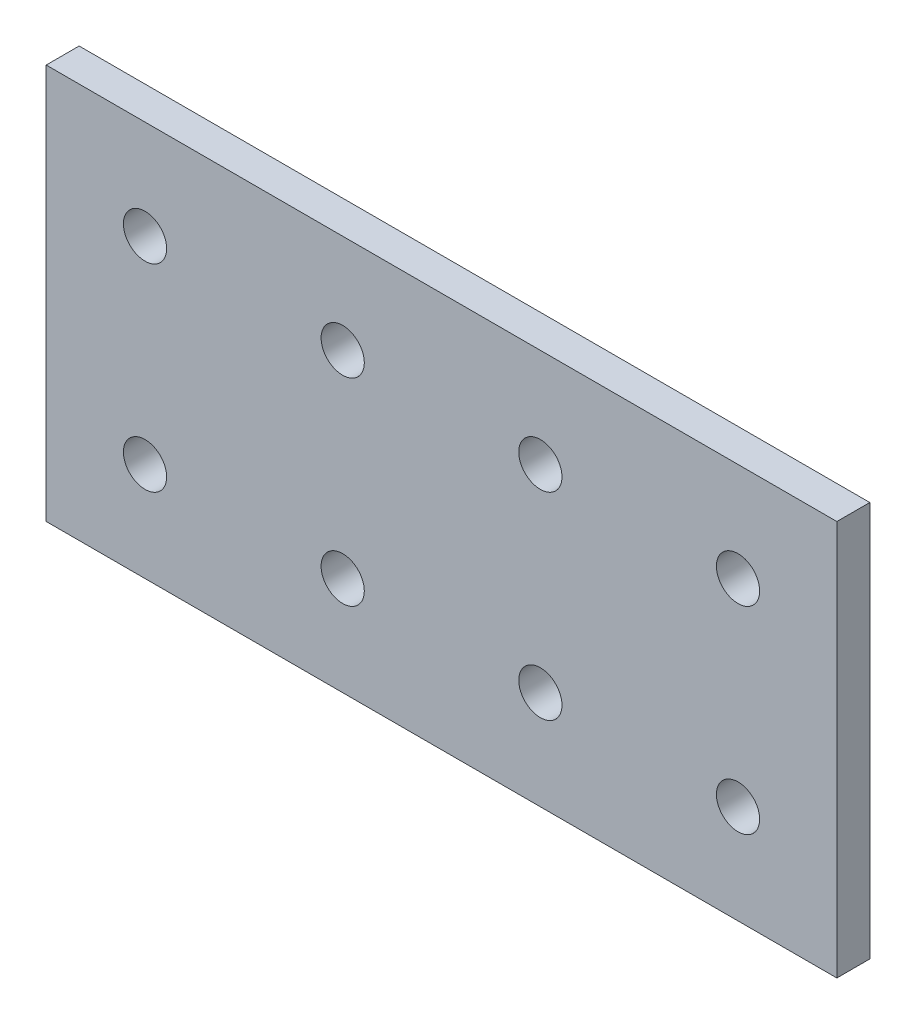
SolidWorks part; units mm, degrees
ref_plane "Front" through (0, 0, 0) normal (0, 0, 1) x (1, 0, 0)
ref_plane "Top" through (0, 0, 0) normal (0, 1, 0) x (1, 0, 0)
ref_plane "Right" through (0, 0, 0) normal (1, 0, 0) x (0, 0, -1)
sketch "Sketch1" plane through (0, 0, 0) normal (0, 0, 1) x (1, 0, 0)
  line L0 (0, 76.2) -> (152.4, 76.2)
  line L1 (0, 0) -> (152.4, 0)
  line L2 (0, 76.2) -> (0, 0)
  line L3 (152.4, 0) -> (152.4, 76.2)
  line L4 (11.7094, 19.05) -> (26.3906, 19.05) construction
  line L5 (19.05, 26.3906) -> (19.05, 11.7094) construction
  line L6 (11.7094, 57.15) -> (26.3906, 57.15) construction
  line L7 (19.05, 64.4906) -> (19.05, 49.8094) construction
  line L8 (49.8094, 19.05) -> (64.4906, 19.05) construction
  line L9 (57.15, 26.3906) -> (57.15, 11.7094) construction
  line L10 (49.8094, 57.15) -> (64.4906, 57.15) construction
  line L11 (57.15, 64.4906) -> (57.15, 49.8094) construction
  line L12 (87.9094, 19.05) -> (102.5906, 19.05) construction
  line L13 (95.25, 26.3906) -> (95.25, 11.7094) construction
  line L14 (87.9094, 57.15) -> (102.5906, 57.15) construction
  line L15 (95.25, 64.4906) -> (95.25, 49.8094) construction
  line L16 (126.0094, 19.05) -> (140.6906, 19.05) construction
  line L17 (133.35, 26.3906) -> (133.35, 11.7094) construction
  line L18 (126.0094, 57.15) -> (140.6906, 57.15) construction
  line L19 (133.35, 64.4906) -> (133.35, 49.8094) construction
  circle A0 centre (19.05, 19.05) radius 4.1656
  circle A1 centre (19.05, 57.15) radius 4.1656
  circle A2 centre (57.15, 19.05) radius 4.1656
  circle A3 centre (57.15, 57.15) radius 4.1656
  circle A4 centre (95.25, 19.05) radius 4.1656
  circle A5 centre (95.25, 57.15) radius 4.1656
  circle A6 centre (133.35, 19.05) radius 4.1656
  circle A7 centre (133.35, 57.15) radius 4.1656
extrude "Extrude1" add sketch "Sketch1" along normal blind 6.35
